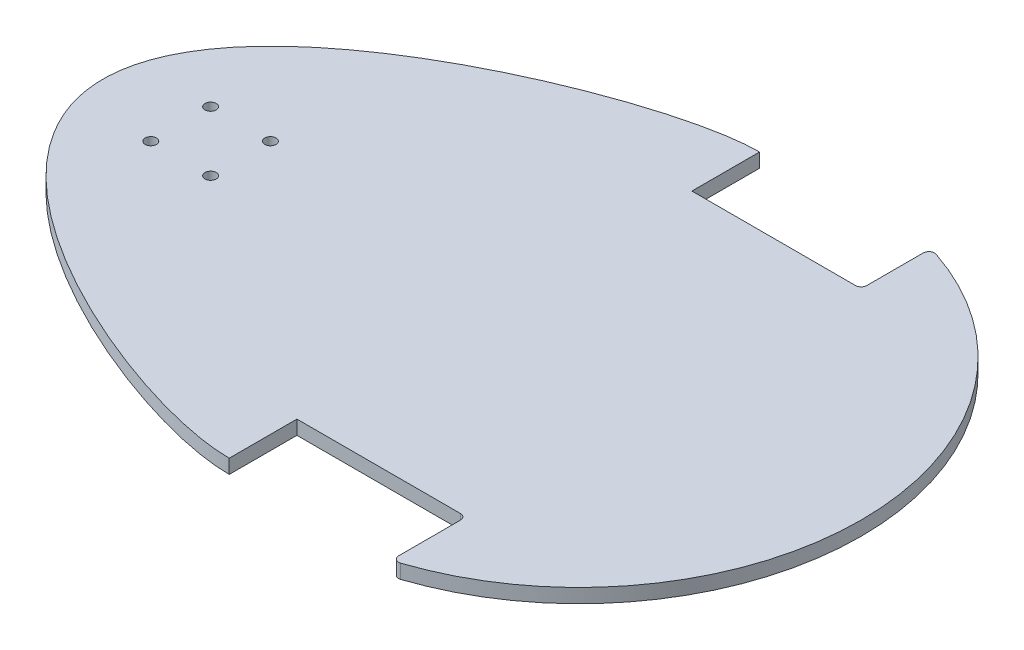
SolidWorks part; units mm, degrees
ref_plane "Front Plane" through (0, 0, 0) normal (0, 0, 1) x (1, 0, 0)
ref_plane "Top Plane" through (0, 0, 0) normal (0, 1, 0) x (1, 0, 0)
ref_plane "Right Plane" through (0, 0, 0) normal (1, 0, 0) x (0, 0, -1)
sketch "Sketch1" plane through (0, 0, 0) normal (0, 1, 0) x (1, 0, 0)
  line L0 (157.2129, 1.1673) -> (157.2129, -24.2327)
  line L1 (81.0129, 3.7073) -> (17.5129, 3.7073) construction
  line L2 (-95.5171, -85.1517) -> (-95.5171, -148.6517) construction
  line L3 (81.0129, -204.5727) -> (154.6729, -204.5727)
  line L4 (81.0129, -26.7727) -> (81.0129, 3.7073)
  line L5 (157.2129, -207.1127) -> (157.2129, -234.9708)
  line L6 (17.5129, 3.7073) -> (-169.1771, -85.1927) construction
  line L7 (81.0129, -204.5727) -> (81.0129, -235.0527)
  line L8 (-169.1771, -85.1927) -> (-169.1771, -146.1527) construction
  line L9 (81.0129, -26.7727) -> (154.6729, -26.7727)
  line L10 (-169.1771, -146.1527) -> (17.5129, -235.0527) construction
  line L11 (17.5129, -235.0527) -> (81.0129, -235.0527) construction
  arc A0 (160.5564, -237.3803) -> (160.5564, 3.5769) centre (120.3829, -116.9017) ccw
  arc A1 (157.2129, 1.1673) -> (160.5564, 3.5769) centre (159.7529, 1.1673) cw
  arc A2 (157.2129, -234.9708) -> (160.5564, -237.3803) centre (159.7529, -234.9708) ccw
  arc A3 (154.6729, -204.5727) -> (157.2129, -207.1127) centre (154.6729, -207.1127) cw
  arc A4 (154.6729, -26.7727) -> (157.2129, -24.2327) centre (154.6729, -24.2327) ccw
  circle A5 centre (-33.2871, -102.2107) radius 2.54
  circle A6 centre (-60.2111, -102.2107) radius 2.54
  circle A7 centre (-60.2111, -129.1347) radius 2.54
  circle A8 centre (-33.2871, -129.1347) radius 2.54
  spline_without_curve S0
  point P16 (114.5137, 87.4439)
  dimension "D3" = 254
  dimension "D6" = 2.54
  dimension "D20" = 75.438
  dimension "D1" = 30.48
  dimension "D2" = 76.2
  dimension "D4" = 76.2
  dimension "D5" = 36.83
  dimension "D7" = 30.48
  dimension "D8" = 215.9
  dimension "D9" = 63.5
  dimension "D10" = 31.75
  dimension "D11" = 63.5
  dimension "D12" = 63.5
  dimension "D13" = 73.66
  dimension "D14" = 177.8
  dimension "D15" = 25.4
  dimension "D16" = 88.9
  dimension "D17" = 88.9
  dimension "D21" = 114.3
  dimension "D18" = 2
  dimension "D19" = 2
extrude "Boss-Extrude1" add sketch "Sketch1" along normal blind 6.35
